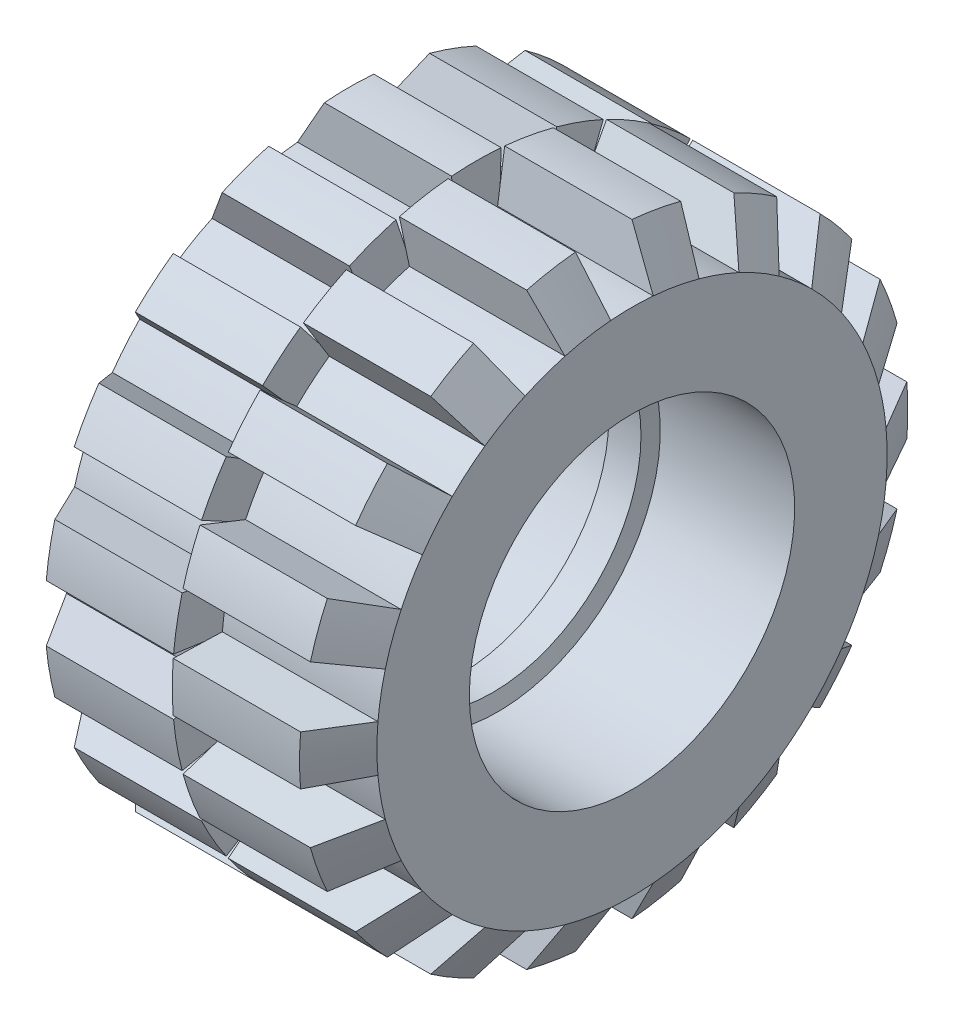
SolidWorks part; units mm, degrees
ref_plane "Face" through (0, 0, 0) normal (0, 0, 1) x (1, 0, 0)
ref_plane "Dessus" through (0, 0, 0) normal (0, 1, 0) x (1, 0, 0)
ref_plane "Droite" through (0, 0, 0) normal (1, 0, 0) x (0, 0, -1)
sketch "Esquisse1" plane through (0, 0, 0) normal (0, 0, 1) x (1, 0, 0)
  line L0 (-5.9158, 5.75) -> (-1.1658, 5.75)
  line L4 (0.3342, 5.75) -> (5.0842, 5.75)
  line L5 (-5.9158, 5.75) -> (-5.9158, 9.0179)
  line L6 (-4.9158, 10.75) -> (4.0842, 10.75)
  line L7 (5.0842, 9.0179) -> (5.0842, 5.75)
  line L8 (-5.9158, 9.0179) -> (-4.9158, 10.75)
  line L9 (4.0842, 10.75) -> (5.0842, 9.0179)
  line L10 (-8.5412, 0) -> (10.0143, 0) construction
  line L11 (-1.1658, 5.75) -> (-0.9838, 5.25)
  line L12 (-0.9838, 5.25) -> (0.1523, 5.25)
  line L13 (0.1523, 5.25) -> (0.3342, 5.75)
  point P7 (-5.9158, 10.75)
  point P8 (5.0842, 10.75)
  dimension "D1" = 0.5
  dimension "D2" = 4.75
  dimension "D3" = 4.75
  dimension "D4" = 110
  dimension "D5" = 110
  dimension "D6" = 1.5
revolve "Base-Révolution" add sketch "Esquisse1" angle 360 about L10
sketch "Esquisse2" plane through (5.0842, 0, 0) normal (1, 0, 0) x (0, 0, -1)
  line L0 (-0.75, 8.9867) -> (-1, 10.7034)
  line L1 (0.75, 8.9867) -> (1, 10.7034)
  line L2 (0, 11.892) -> (0, 2.4526) construction
  arc A0 (1, 10.7034) -> (-1, 10.7034) centre (0, 0) ccw
  arc A1 (0.75, 8.9867) -> (-0.75, 8.9867) centre (0, 0) ccw
  circle A2 centre (0, 0) radius 10.75 construction
  circle A3 centre (0, 0) radius 9.0179 construction
  dimension "D4" = 1
  dimension "D1" = 0.75
  dimension "D2" = 0.75
  dimension "D3" = 1
extrude "Enlèv. mat.-Extru.1" cut sketch "Esquisse2" against normal blind 5.5
pattern_circular "Répétition circulaire1" count 18 over 360 about axis through (0, 0, 0) along (1, 0, 0) of "Enlèv. mat.-Extru.1"
sketch "Esquisse3" plane through (-5.9158, 0, 0) normal (-1, 0, 0) x (0, 0, 1)
  line L0 (-2.8434, 10.3671) -> (-2.2991, 8.7199)
  line L1 (-0.8219, 8.9804) -> (-0.8738, 10.7144)
  line L2 (-1.566, 8.8809) -> (-2.0916, 11.8618) construction
  arc A0 (-0.8738, 10.7144) -> (-2.8434, 10.3671) centre (0, 0) ccw
  arc A1 (-0.8219, 8.9804) -> (-2.2991, 8.7199) centre (0, 0) ccw
  circle A4 centre (0, 0) radius 10.75 construction
  dimension "D2" = 1
  dimension "D3" = 1
  dimension "D4" = 0.75
  dimension "D5" = 0.75
extrude "Enlèv. mat.-Extru.2" cut sketch "Esquisse3" against normal blind 5.5
pattern_circular "Répétition circulaire2" count 18 over 360 about axis through (0, 0, 0) along (1, 0, 0) of "Enlèv. mat.-Extru.2"
